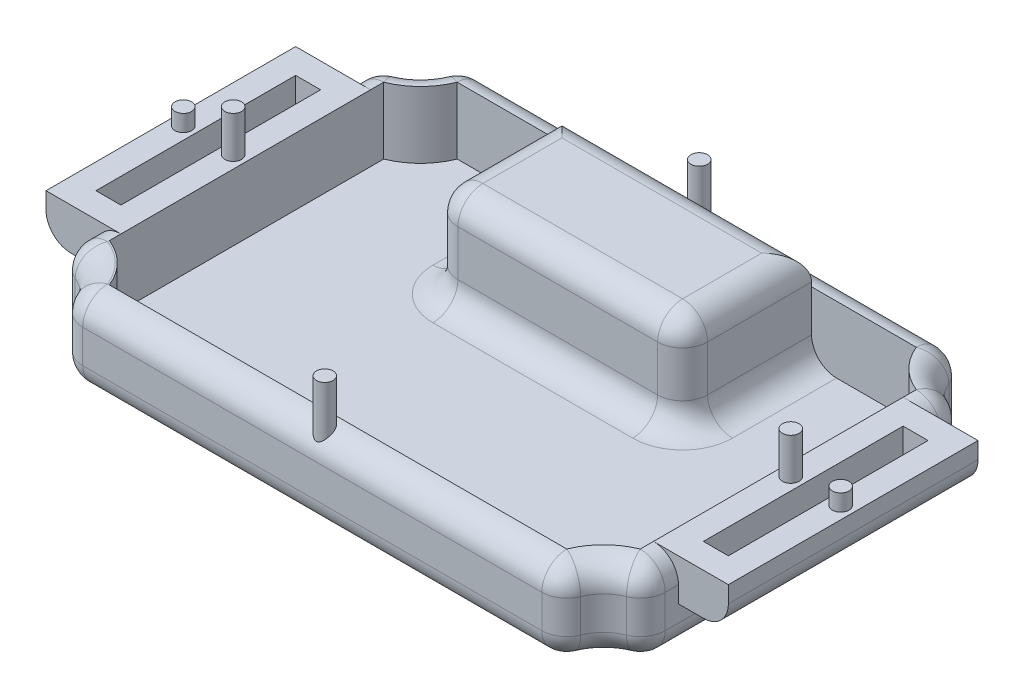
SolidWorks part; units mm, degrees
ref_plane "Front Plane" through (0, 0, 0) normal (0, 0, 1) x (1, 0, 0)
ref_plane "Top Plane" through (0, 0, 0) normal (0, 1, 0) x (1, 0, 0)
ref_plane "Right Plane" through (0, 0, 0) normal (1, 0, 0) x (0, 0, -1)
sketch "Sketch1" plane through (0, 0, 0) normal (0, 1, 0) x (1, 0, 0)
  line L1 (30, 24) -> (-30, 24)
  line L2 (35, 19) -> (35, -19)
  line L3 (30, -24) -> (-30, -24)
  line L4 (-35, 19) -> (-35, -19)
  line L5 (35, 24) -> (-35, -24) construction
  line L6 (35, -24) -> (-35, 24) construction
  arc A0 (-35, 19) -> (-30, 24) centre (-35, 24) ccw
  arc A1 (30, 24) -> (35, 19) centre (35, 24) ccw
  arc A2 (-30, -24) -> (-35, -19) centre (-35, -24) ccw
  arc A3 (35, -19) -> (30, -24) centre (35, -24) ccw
  point P0 (0, 0)
  dimension "D1" = 70
  dimension "D2" = 48
extrude "Boss-Extrude1" add sketch "Sketch1" along normal blind 10
sketch "Sketch2" plane through (0, 10, 0) normal (0, 1, 0) x (1, 0, 0)
  line L0 (-27.5838, 21) -> (27.5838, 21)
  line L1 (32, 16.5838) -> (32, -16.5838)
  line L2 (-27.3874, -21) -> (27.5838, -21)
  line L3 (-32, 16.5838) -> (-32, -16.3874)
  line L4 (30, 24) -> (-30, 24) construction
  line L5 (-35, 19) -> (-35, -19) construction
  line L6 (35, -19) -> (35, 19) construction
  line L7 (-30, -24) -> (30, -24) construction
  arc A0 (-32, 16.5838) -> (-27.5838, 21) centre (-35, 24) ccw
  arc A1 (-27.3874, -21) -> (-32, -16.3874) centre (-35, -24) ccw
  arc A2 (27.5838, 21) -> (32, 16.5838) centre (35, 24) ccw
  arc A3 (32, -16.5838) -> (27.5838, -21) centre (35, -24) ccw
  arc A4 (-30, -24) -> (-35, -19) centre (-35, -24) ccw construction
  arc A5 (-35, 19) -> (-30, 24) centre (-35, 24) ccw construction
  arc A6 (30, 24) -> (35, 19) centre (35, 24) ccw construction
  arc A7 (35, -19) -> (30, -24) centre (35, -24) ccw construction
  dimension "D1" = 3
  dimension "D2" = 3
  dimension "D3" = 3
  dimension "D4" = 3
extrude "Cut-Extrude1" cut sketch "Sketch2" against normal blind 8
sketch "Sketch3" plane through (0, 10, 0) normal (0, 1, 0) x (1, 0, 0)
  line L0 (0, 0) -> (-43.0713, 0) construction
  line L1 (0, 0) -> (48.1157, 0) construction
  line L2 (-33.5, 5.6911) -> (-33.5, -7.6312) construction
  line L3 (33.5, 5.6911) -> (33.5, -7.6312) construction
  line L4 (0, 0) -> (0, -29.4902) construction
  line L5 (0, 0) -> (0, 28.1968) construction
  line L6 (-4.527, 22.5) -> (5.3031, 22.5) construction
  line L7 (-4.527, -22.5) -> (6.9845, -22.5) construction
  line L8 (-35, 19) -> (-35, -19) construction
  line L9 (30, 24) -> (-30, 24) construction
  line L12 (32, -16.5838) -> (32, 16.5838) construction
  line L13 (-27.3874, -21) -> (27.5838, -21) construction
  circle A0 centre (-33.5, 0) radius 1
  circle A1 centre (0, 22.5) radius 1
  circle A2 centre (33.5, 0) radius 1
  circle A3 centre (0, -22.5) radius 1
  point P30 (0, 0)
  dimension "D1" = 1.5
  dimension "D2" = 1.5
  dimension "D3" = 1.5
  dimension "D4" = 1.5
sketch "Sketch4" plane through (0, 10, 0) normal (0, 1, 0) x (1, 0, 0)
  line L0 (35, -19) -> (35, 19) construction
  line L4 (35, 15) -> (35, 12)
  line L5 (35, 12) -> (35, 0)
  line L7 (-35, 19) -> (-35, -19) construction
  line L8 (-35, 15) -> (-41, 15)
  line L9 (-35, 15) -> (-35, -15)
  line L10 (-35, -15) -> (-41, -15)
  line L11 (-41, 15) -> (-41, -15)
  line L12 (-35, 15) -> (-41, -15) construction
  line L13 (-35, -15) -> (-41, 15) construction
  line L14 (0, 0) -> (-43.9534, 0) construction
  line L15 (0, 0) -> (53.124, 0) construction
  line L20 (35, 0) -> (35, -15)
  line L21 (41, 15) -> (35, 15)
  line L23 (-35, 12) -> (-38, 12)
  line L24 (-35, 12) -> (-35, -12)
  line L25 (-35, -12) -> (-38, -12)
  line L26 (-38, 12) -> (-38, -12)
  line L27 (-35, 12) -> (-38, -12) construction
  line L28 (-35, -12) -> (-38, 12) construction
  line L29 (41, 15) -> (41, -15)
  line L30 (41, -15) -> (35, -15)
  line L31 (35, 15) -> (35, -15)
  line L32 (41, 15) -> (35, -15) construction
  line L33 (41, -15) -> (35, 15) construction
  line L34 (35, 12) -> (38, 12)
  line L35 (35, 12) -> (35, -12)
  line L36 (35, -12) -> (38, -12)
  line L37 (38, 12) -> (38, -12)
  point P0 (38, 0)
  point P2 (38, 0)
  point P7 (-38, 0)
  point P14 (-38, 15)
  point P19 (38, 0)
  point P24 (-36.5, 0)
  point P29 (36.6175, 0)
  point P35 (38, 15)
  dimension "D1" = 6
  dimension "D2" = 30
  dimension "D3" = 3
  dimension "D4" = 3
  dimension "D5" = 15
  dimension "D6" = 15
  dimension "D7" = 3
  dimension "D8" = 6
  dimension "D9" = 3
  dimension "D10" = 0
  dimension "D11" = 3
extrude "Boss-Extrude2" add sketch "Sketch4" against normal blind 5 contours L26 L23 L9 L8 L11 L10 L25 | L34 L37 L36 L20 L30 L29 L21 L4 M30
sketch "Sketch5" plane through (0, 10, 0) normal (0, 1, 0) x (1, 0, 0)
  line L0 (0, 0) -> (-50.0004, 0) construction
  line L1 (-39.5, 7.2728) -> (-39.5, -6.6667) construction
  line L2 (0, 0) -> (52.8792, 0) construction
  line L3 (39.5, 8.6364) -> (39.5, -6.6667) construction
  line L4 (-41, 15) -> (-41, -15) construction
  line L5 (41, 15) -> (41, -15) construction
  circle A0 centre (-39.5, 0) radius 1
  circle A1 centre (39.5, 0) radius 1
  dimension "D1" = 1.5
  dimension "D2" = 1.5
fillet "Fillet3" radius 3 1 edges at (-41, 5, 0)
extrude "Boss-Extrude4" add sketch "Sketch5" along normal blind 2 contours A0 | A1
extrude "Boss-Extrude5" add sketch "Sketch3" along normal blind 5 contours A3 | A2 | A1 | A0
fillet "Fillet4" radius 3 1 edges at (41, 5, 0)
fillet "Fillet5" radius 3 8 edges at (-35, 5, -19) (-30, 5, -24) (30, 5, -24) (35, 5, -19) (30, 5, 24) (35, 5, 19) (-30, 5, 24) (-35, 5, 19)
fillet "Fillet6" radius 3 34 edges at (35, 10, -15.7919) (34.4875, 10, -18.2609) (34.4875, 0, -18.2609) (-35, 10, -15.7919) (-34.4875, 10, -18.2609) (-34.4875, 0, -18.2609) (-29.2609, 10, -23.4875) (-29.2609, 0, -23.4875) (0, 0, -24) (0, 10, -24) (29.2609, 10, -23.4875) (29.2609, 0, -23.4875) (-35, 10, 15.7919) (-34.4875, 10, 18.2609) (-34.4875, 0, 18.2609) (35, 10, 15.7919) (34.4875, 10, 18.2609) (34.4875, 0, 18.2609) (29.2609, 10, 23.4875) (29.2609, 0, 23.4875) (0, 0, 24) (0, 10, 24) (-29.2609, 10, 23.4875) (-29.2609, 0, 23.4875) (-35, 0, 0) (35, 0, 0) (-31.4645, 0, -20.4645) (-31.4645, 10, -20.4645) (31.4645, 0, -20.4645) (31.4645, 10, -20.4645) (31.4645, 0, 20.4645) (31.4645, 10, 20.4645) (-31.4645, 0, 20.4645) (-31.4645, 10, 20.4645)
sketch "Sketch11" plane through (0, 0, 0) normal (0, -1, 0) x (-1, 0, 0)
  line L0 (0, 29.7374) -> (0, -7.7597) construction
  line L1 (27.5838, 21) -> (-27.5838, 21) construction
  line L2 (-15, 5.5) -> (15, 5.5)
  line L3 (-15, 5.5) -> (-15, 21)
  line L4 (-15, 21) -> (15, 21)
  line L5 (15, 5.5) -> (15, 21)
  line L6 (-15, 5.5) -> (15, 21) construction
  line L7 (-15, 21) -> (15, 5.5) construction
  point P3 (0, 13.25)
  dimension "D1" = 15.5
  dimension "D2" = 30
extrude "Cut-Extrude7" cut sketch "Sketch11" against normal blind 1 contours L3 L2 L5 L4
sketch "Sketch12" plane through (0, 1, 0) normal (0, -1, 0) x (1, 0, 0)
  line L0 (-15, -5.5) -> (-15, -21) construction
  line L1 (15, -5.5) -> (-15, -5.5)
  line L2 (15, -5.5) -> (15, -21)
  line L3 (15, -21) -> (-15, -21)
  line L4 (-15, -5.5) -> (-15, -21)
  line L5 (15, -5.5) -> (-15, -21) construction
  line L6 (15, -21) -> (-15, -5.5) construction
  line L7 (15, -5.5) -> (-15, -5.5) construction
  line L8 (15, -5.5) -> (15, -21) construction
  line L9 (15, -21) -> (-15, -21) construction
  point P0 (0, -13.25)
  point P13 (0, 0)
  point P14 (0, 0)
  point P15 (0, 0)
  point P16 (0, 0)
  dimension "D1" = 0
  dimension "D2" = 0
  dimension "D3" = 0
sketch "Sketch16" plane through (0, 1, 0) normal (0, -1, 0) x (1, 0, 0)
  line L0 (-15, -5.5) -> (-15, -21) construction
  line L1 (14, -6.5) -> (-14, -6.5)
  line L2 (14, -6.5) -> (14, -20)
  line L3 (14, -20) -> (-14, -20)
  line L4 (-14, -6.5) -> (-14, -20)
  line L5 (14, -6.5) -> (-14, -20) construction
  line L6 (14, -20) -> (-14, -6.5) construction
  line L7 (15, -5.5) -> (-15, -5.5) construction
  point P0 (0, -13.25)
  dimension "D1" = 1
  dimension "D2" = 1
extrude "Boss-Extrude12" add sketch "Sketch16" against normal blind 12.5
sketch "Sketch17" plane through (0, 1, 0) normal (0, -1, 0) x (1, 0, 0)
  line L0 (15, -5.5) -> (-15, -21) construction
  line L1 (15, -5.5) -> (-15, -5.5)
  line L2 (15, -5.5) -> (15, -21)
  line L3 (15, -21) -> (-15, -21)
  line L4 (-15, -5.5) -> (-15, -21)
  line L5 (15, -5.5) -> (-15, -21) construction
  line L6 (15, -21) -> (-15, -5.5) construction
  line L7 (15, -5.5) -> (-15, -5.5) construction
  point P0 (0, -13.25)
  dimension "D1" = 0
extrude "Boss-Extrude13" add sketch "Sketch17" against normal blind 12.5 contours L2 L1 L4 L3
sketch "Sketch18" plane through (0, 1, 0) normal (0, -1, 0) x (1, 0, 0)
  line L0 (15, -5.5) -> (-15, -5.5) construction
  line L1 (14, -6.5) -> (-14, -6.5)
  line L2 (14, -6.5) -> (14, -20)
  line L3 (14, -20) -> (-14, -20)
  line L4 (-14, -6.5) -> (-14, -20)
  line L5 (14, -6.5) -> (-14, -20) construction
  line L6 (14, -20) -> (-14, -6.5) construction
  line L7 (15, -5.5) -> (15, -21) construction
  point P0 (0, -13.25)
  dimension "D1" = 1
  dimension "D2" = 1
sketch "Sketch20" plane through (0, 1, 0) normal (0, -1, 0) x (1, 0, 0)
  line L1 (14, -6.5) -> (-14, -6.5)
  line L2 (14, -6.5) -> (14, -20)
  line L3 (14, -20) -> (-14, -20)
  line L4 (-14, -6.5) -> (-14, -20)
  line L5 (14, -6.5) -> (-14, -20) construction
  line L6 (14, -20) -> (-14, -6.5) construction
  point P0 (0, -13.25)
extrude "Cut-Extrude10" cut sketch "Sketch20" against normal blind 5.65
sketch "Sketch21" plane through (0, 6.65, 0) normal (0, -1, 0) x (1, 0, 0)
  line L0 (-25.6466, -13.25) -> (64.1547, -13.25) construction
  line L1 (-12, -13.25) -> (12, -13.25)
  line L4 (12, -7.5) -> (-12, -7.5)
  line L5 (12, -7.5) -> (12, -13.25)
  line L7 (-12, -7.5) -> (-12, -13.25)
  line L8 (12, -7.5) -> (-12, -19) construction
  line L9 (12, -19) -> (-12, -7.5) construction
  dimension "D1" = 11.5
  dimension "D2" = 24
revolve "Cut-Revolve5" cut sketch "Sketch21" angle 180 about L0
sketch "Sketch22" plane through (0, 6.65, 0) normal (0, -1, 0) x (1, 0, 0)
  line L1 (14, -6.5) -> (-14, -6.5)
  line L2 (14, -6.5) -> (14, -20)
  line L3 (14, -20) -> (-14, -20)
  line L4 (-14, -6.5) -> (-14, -20)
  line L5 (14, -6.5) -> (-14, -20) construction
  line L6 (14, -20) -> (-14, -6.5) construction
  point P0 (0, -13.25)
  point P5 (-14, -6.5)
  point P10 (0, 0)
  point P11 (0, 0)
  point P14 (-14, -6.5)
extrude "Cut-Extrude11" cut sketch "Sketch22" against normal blind 0.75
fillet "Fillet7" radius 3 9 edges at (15, 2, -13.25) (-15, 2, -13.25) (0, 2, -5.5) (0, 13.5, -5.5) (15, 7.75, -5.5) (-15, 7.75, -5.5) (0, 13.5, -21) (15, 13.5, -13.25) (-15, 13.5, -13.25)
